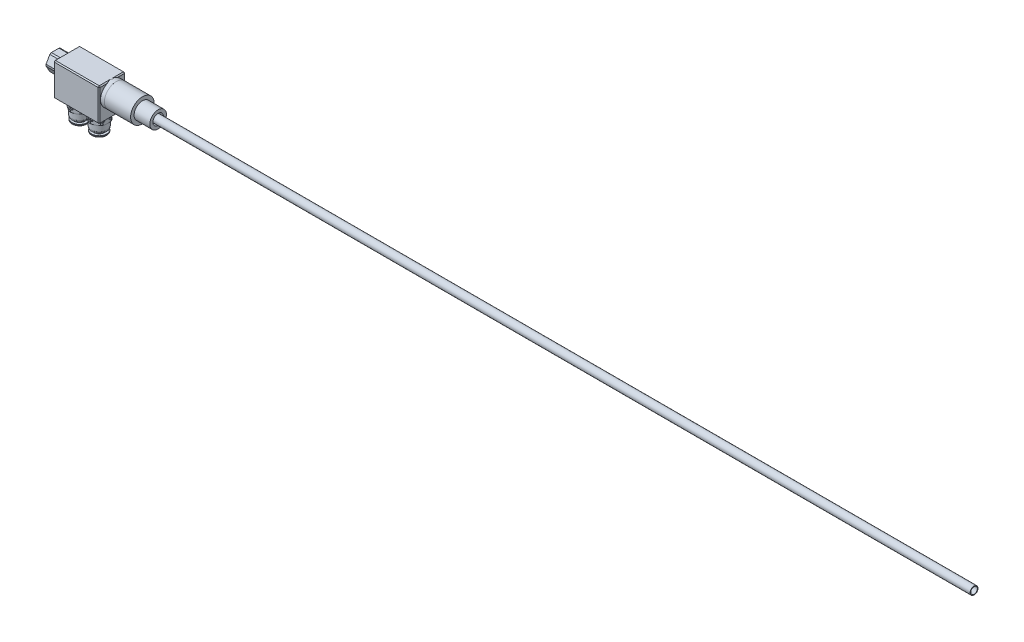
SolidWorks part; units mm, degrees
other "MLFS25-"
other "MLFS25"
ref_plane "Front Plane" through (0, 0, 0) normal (0, 0, 1) x (1, 0, 0)
ref_plane "Top Plane" through (0, 0, 0) normal (0, 1, 0) x (1, 0, 0)
ref_plane "Right Plane" through (0, 0, 0) normal (1, 0, 0) x (0, 0, -1)
sketch "Sketch1" plane through (0, 0, 0) normal (0, 0, 1) x (1, 0, 0)
  line L0 (-71.9924, 0) -> (105.9462, 0) construction
  line L1 (0, 6.35) -> (0, 9.0043)
  line L2 (0, 9.0043) -> (-20, 9.0043)
  line L3 (-20, 9.0043) -> (-20, 9.017)
  line L4 (-20, 9.017) -> (-23, 9.017)
  line L5 (-23, 9.017) -> (-23, 4)
  line L7 (0, 6.35) -> (11.9888, 6.35)
  line L8 (11.9888, 6.35) -> (11.9888, 4)
  line L10 (-23, 4) -> (11.9888, 4)
  dimension "D1" = 23
  dimension "D2" = 18.0086
  dimension "D3" = 18.034
  dimension "D4" = 3
  dimension "D5" = 12.7
  dimension "D6" = 11.9888
  dimension "D7" = 8
revolve "Revolve1" add sketch "Sketch1" angle 360 about L0
sketch "Sketch2" plane through (0, 0, 0) normal (0, 0, 1) x (1, 0, 0)
  line L0 (0, 0) -> (-72.5041, 0) construction
  line L1 (-23, 9) -> (-58, 9)
  line L2 (-23, 9) -> (-23, -16)
  line L3 (-23, -16) -> (-58, -16)
  line L4 (-58, 9) -> (-58, -16)
  line L5 (-23, 9.017) -> (-23, -9.017) construction
  dimension "D1" = 9
  dimension "D2" = 25
  dimension "D3" = 35
extrude "Boss-Extrude1" add sketch "Sketch2" along normal mid plane 20
sketch "Sketch3" plane through (0, 0, 0) normal (0, 0, 1) x (1, 0, 0)
  line L0 (-58, 6.985) -> (-66.636, 6.985)
  line L1 (-58, 9) -> (-58, -16) construction
  line L2 (-66.636, 6.985) -> (-66.636, 0)
  line L3 (-66.636, 0) -> (-58, 0)
  line L4 (-58, 0) -> (-58, 6.985)
  line L5 (-58, 0) -> (-71.1377, 0) construction
  dimension "D1" = 8.636
  dimension "D2" = 13.97
revolve "Revolve2" add sketch "Sketch3" angle 360 about L5
hole_wizard "1/8 NPT Tapped Hole1" positions "Sketch5" profile "Sketch4" size "1/8" standard "ANSI Inch"
sketch "Sketch5" plane through (0, -16, 0) normal (0, -1, 0) x (-1, 0, 0)
  line L0 (23, -10) -> (23, 10) construction
  point P0 (33, 0)
  point P2 (48, 0)
  dimension "D1" = 10
  dimension "D2" = 15
sketch "Sketch4" plane through (-33, -16, 0) normal (1, 0, 0) x (0, 0, -1)
  line L0 (0, 0) -> (0, 14.2175)
  line L1 (4.2164, 11.684) -> (0, 14.2175)
  line L2 (-4.2164, 11.684) -> (0, 14.2175) construction
  line L3 (4.2164, 11.684) -> (4.2164, 6.858)
  line L4 (4.2164, 6.858) -> (4.5374, 6.858)
  line L5 (4.5374, 6.858) -> (4.7427, 0)
  line L6 (-4.5374, 6.858) -> (-4.7427, 0) construction
  line L7 (4.7427, 0) -> (0, 0)
  line L8 (0, -6.35) -> (0, 107.95) construction
  line L11 (-4.2164, 6.858) -> (-4.5374, 6.858) construction
  dimension "Tap Drill Dia." = 8.4328
  dimension "Tap Drill Depth" = 11.684
  dimension "Thread Dia." = 9.4855
  dimension "Thread Angle" = 3.43
  dimension "Thread Depth" = 6.858
  dimension "Drill Angle" = 118
chamfer "Chamfer1" distance 0.762 angle 45 13 edges at (-40.5, 9, -10) (-58, -3.5, -10) (-40.5, -16, -10) (-23, -3.5, -10) (-40.5, -16, 10) (-58, -3.5, 10) (-40.5, 9, 10) (-23, -3.5, 10) (-58, -16, 0) (-58, 9, 0) (-23, 9, 5.2767) (-23, 9, -5.2767) (-23, -16, 0)
sketch "Sketch7" plane through (0, 0, 0) normal (0, 0, 1) x (1, 0, 0)
  line L0 (0, 0) -> (234.4454, 0) construction
  line L1 (-23, 2.9972) -> (635, 2.9972)
  line L3 (635, 2.9972) -> (635, 2.5146)
  line L4 (-23, 8.238) -> (-23, -15.238) construction
  line L5 (-23, 2.5146) -> (-23, 2.9972)
  line L9 (-23, 2.5146) -> (635, 2.5146)
  dimension "D1" = 5.9944
  dimension "D2" = 635
  dimension "D3" = 5.0292
revolve "Revolve4" add sketch "Sketch7" angle 360 about L0
sketch "Sketch8" plane through (-66.636, 0, 0) normal (-1, 0, 0) x (0, 0, 1)
  line L1 (1.8331, -3.175) -> (3.6662, 0)
  line L2 (3.6662, 0) -> (1.8331, 3.175)
  line L3 (1.8331, 3.175) -> (-1.8331, 3.175)
  line L4 (-1.8331, 3.175) -> (-3.6662, 0)
  line L5 (-3.6662, 0) -> (-1.8331, -3.175)
  line L6 (-1.8331, -3.175) -> (1.8331, -3.175)
  circle A0 centre (0, 0) radius 3.175 construction
  dimension "D1" = 6.35
extrude "Cut-Extrude1" cut sketch "Sketch8" against normal blind 6.604
sketch "Sketch9" plane through (-66.636, 0, 0) normal (-1, 0, 0) x (0, 0, 1)
  line L1 (-3.6662, 6.35) -> (-7.3323, 0)
  line L2 (-7.3323, 0) -> (-3.6662, -6.35)
  line L3 (-3.6662, -6.35) -> (3.6662, -6.35)
  line L4 (3.6662, -6.35) -> (7.3323, 0)
  line L5 (7.3323, 0) -> (3.6662, 6.35)
  line L6 (3.6662, 6.35) -> (-3.6662, 6.35)
  circle A0 centre (0, 0) radius 6.35 construction
  dimension "D1" = 12.7
extrude "Cut-Extrude2" cut sketch "Sketch9" against normal up to surface (8.636 mm away) flip side to cut
inserted part "MLFS25"
move or copy body "Body-Move/Copy2" placed by mates yes
other "Distance1" parameters "D1"=0.762
inserted part "MLFS25-"
move or copy body "Body-Move/Copy4" placed by mates yes
other "Distance3" parameters "D1"=0.762
sketch "Sketch10" plane through (0, 0, -10) normal (0, 0, -1) x (-1, 0, 0)
  line L0 (34.0054, -11.9058) -> (34.0054, 2.0518) construction
  line L1 (49.566, -11.9058) -> (49.566, -2.5226) construction
  text T0 "OUT"
  text T1 "IN"
extrude "Cut-Extrude3" cut sketch "Sketch10" against normal blind 0.127
